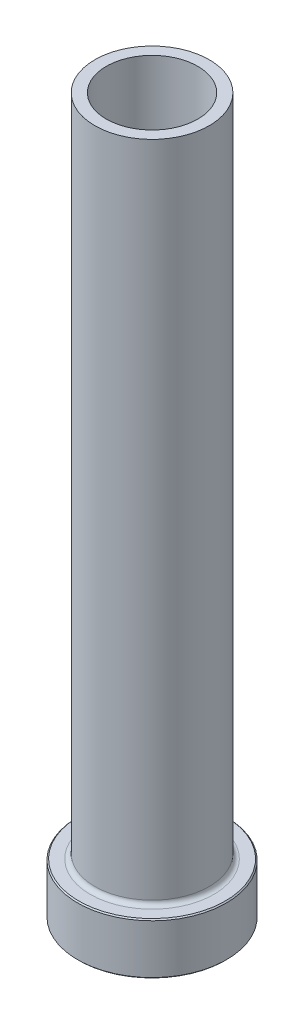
SolidWorks part; units mm, degrees
ref_plane "Front Plane" through (0, 0, 0) normal (0, 0, 1) x (1, 0, 0)
ref_plane "Top Plane" through (0, 0, 0) normal (0, 1, 0) x (1, 0, 0)
ref_plane "Right Plane" through (0, 0, 0) normal (1, 0, 0) x (0, 0, -1)
sketch "Sketch1" plane through (0, 0, 0) normal (0, 0, 1) x (1, 0, 0)
  line L0 (-8, 125) -> (-10, 125)
  line L1 (-10, 125) -> (-10, 9)
  line L2 (-10, 9) -> (-13, 9)
  line L3 (-13, 9) -> (-13, 0)
  line L4 (14.3, 0) -> (-14.3, 0) construction
  line L5 (-13, 0) -> (-8.25, 0)
  line L6 (-8, 70) -> (-8, 125)
  line L7 (0, 92.1877) -> (0, -15.5353) construction
  line L8 (0, -14.3) -> (0, 14.3) construction
  line L9 (-8, 70) -> (-8.25, 58)
  line L10 (-8.25, 58) -> (-8.25, 0)
  dimension "D1" = 0.25
  dimension "ID" = 16
  dimension "OD" = 20
  dimension "L" = 125
  dimension "H" = 26
  dimension "T" = 9
  dimension "N" = 55
  dimension "D2" = 12
revolve "Revolve1" add sketch "Sketch1" angle 360 about L7
fillet "Fillet1" radius 0.8 1 edges at (0, 9, 10)
chamfer "Chamfer1" distance 0.2 angle 45 2 edges at (0, 9, 13) (0, 0, 13)
chamfer "Chamfer3" distance 0.5 angle 45 1 edges at (0, 0, 8.25)
